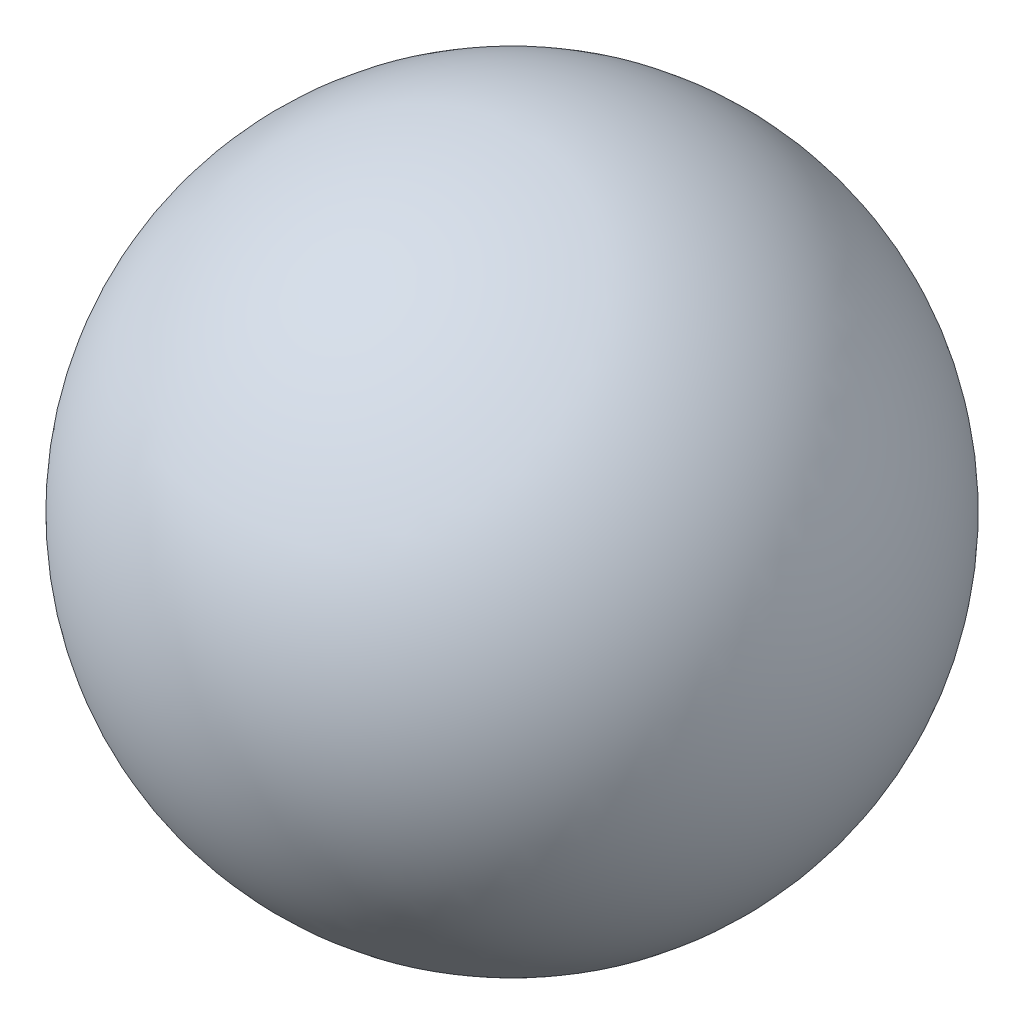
SolidWorks part; units mm, degrees
ref_plane "Front" through (0, 0, 0) normal (0, 0, 1) x (1, 0, 0)
ref_plane "Top" through (0, 0, 0) normal (0, 1, 0) x (1, 0, 0)
ref_plane "Right" through (0, 0, 0) normal (1, 0, 0) x (0, 0, -1)
sketch "Sketch1"
  dimension "D1" = 38.839
  dimension "D2" = 130.8576
  dimension "D3" = 6.7196
revolve "Revolve1" add sketch "Sketch1" angle 360 about L0
sketch "Sketch2"
  dimension "D1" = 164.2931
  dimension "D2" = 168.2957
  dimension "D3" = 10.3998
